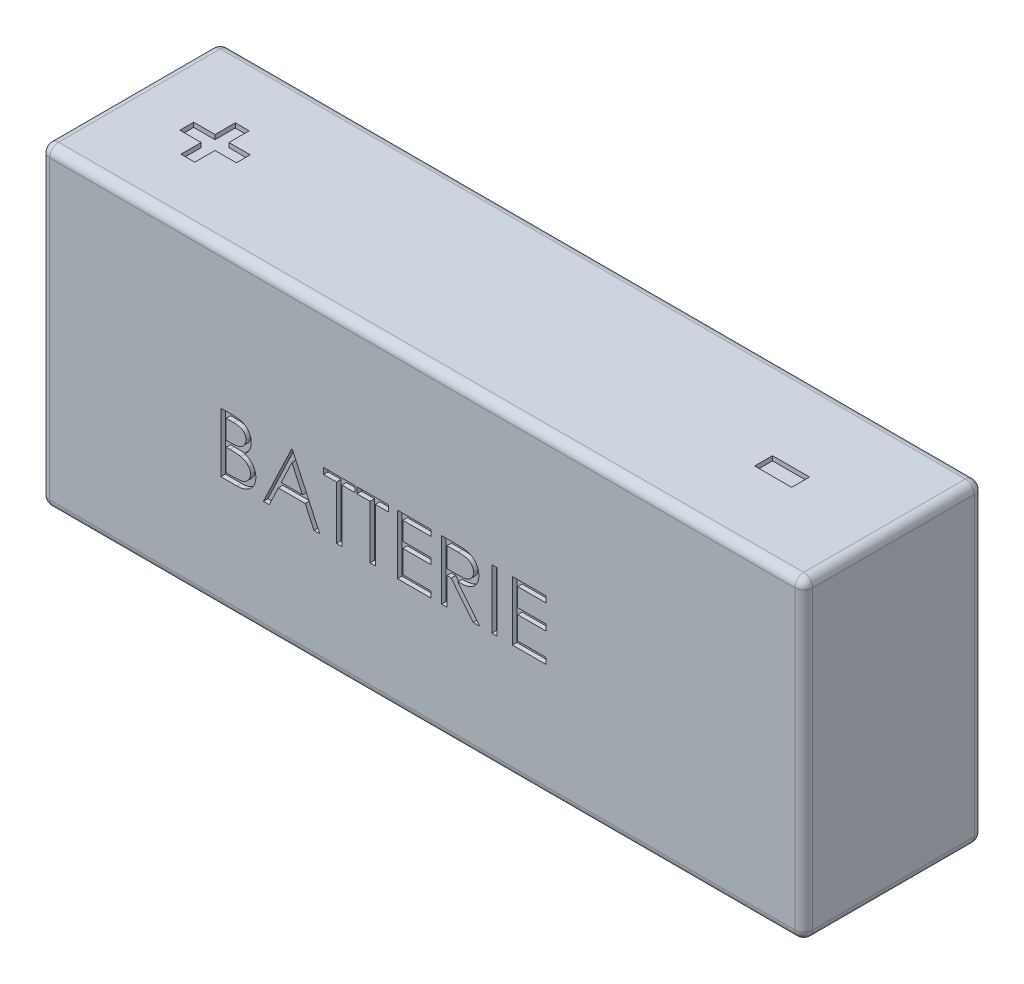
SolidWorks part; units mm, degrees
ref_plane "Plan de face" through (0, 0, 0) normal (0, 0, 1) x (1, 0, 0)
ref_plane "Plan de dessus" through (0, 0, 0) normal (0, 1, 0) x (1, 0, 0)
ref_plane "Plan de droite" through (0, 0, 0) normal (1, 0, 0) x (0, 0, -1)
sketch "Esquisse1" plane through (0, 0, 0) normal (0, 0, 1) x (1, 0, 0)
  line L1 (0, 0) -> (170, 0)
  line L2 (0, 0) -> (0, -70)
  line L3 (0, -70) -> (170, -70)
  line L4 (170, 0) -> (170, -70)
  dimension "D1" = 170
  dimension "D2" = 70
extrude "Boss.-Extru.1" add sketch "Esquisse1" along normal blind 40
fillet "Congé1" radius 2 12 edges at (0, -70, 20) (0, -35, 0) (85, -70, 0) (170, -35, 0) (170, -70, 20) (0, -35, 40) (85, -70, 40) (170, -35, 40) (170, 0, 20) (85, 0, 40) (0, 0, 20) (85, 0, 0)
sketch "Esquisse2" plane through (0, 0, 40) normal (0, 0, 1) x (1, 0, 0)
  text T0 "BATTERIE" font "Century Gothic" height in points 50
extrude "Enlèv. mat.-Extru.1" cut sketch "Esquisse2" against normal blind 1
sketch "Esquisse3" plane through (0, 0, 0) normal (0, 1, 0) x (1, 0, 0)
  text T0 "+" font "Century Gothic" height in points 70
extrude "Enlèv. mat.-Extru.2" cut sketch "Esquisse3" against normal blind 1
sketch "Esquisse4" plane through (0, 0, 0) normal (0, 1, 0) x (1, 0, 0)
  text T0 "-" font "Century Gothic" height in points 90
extrude "Enlèv. mat.-Extru.3" cut sketch "Esquisse4" against normal blind 1
